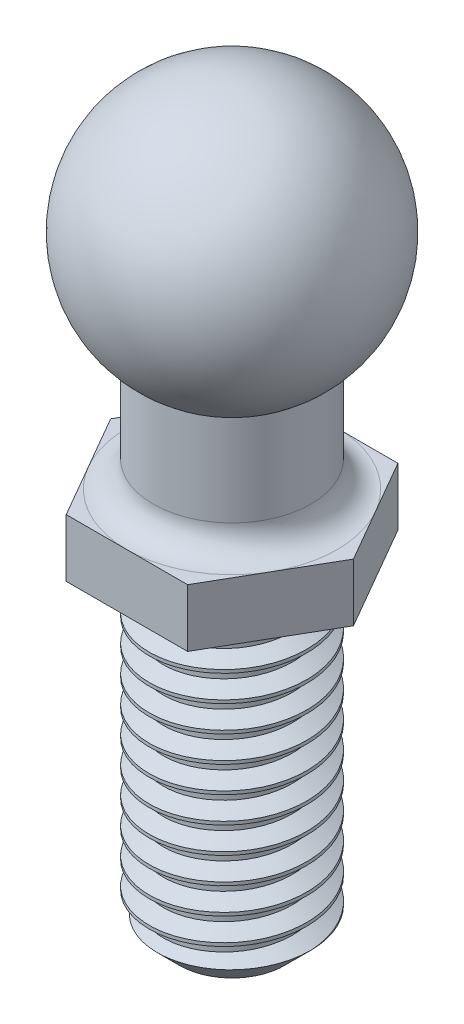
SolidWorks part; units mm, degrees
ref_plane "Plan de face" through (0, 0, 0) normal (0, 0, 1) x (1, 0, 0)
ref_plane "Plan de dessus" through (0, 0, 0) normal (0, 1, 0) x (1, 0, 0)
ref_plane "Plan de droite" through (0, 0, 0) normal (1, 0, 0) x (0, 0, -1)
sketch "Esquisse1" plane through (0, 0, 0) normal (0, 0, 1) x (1, 0, 0)
  line L0 (0, 34.3479) -> (0, -13.7179) construction
  line L1 (3, 19.17) -> (3, 0)
  line L2 (3, 0) -> (0, 0)
  line L3 (0, 28.17) -> (0, 0)
  arc A0 (0, 28.17) -> (3, 19.17) centre (0, 23.17) cw
  dimension "D1" = 5
  dimension "D2" = 3
  dimension "D3" = 19.17
revolve "Révolution1" add sketch "Esquisse1" angle 360 about L0
ref_plane "Plan1" through (0, 12.5, 0) normal (0, -1, 0) x (-1, 0, 0)
sketch "Esquisse2" plane through (0, 12.5, 0) normal (0, -1, 0) x (-1, 0, 0)
  line L1 (2.3094, -4) -> (4.6188, 0)
  line L2 (4.6188, 0) -> (2.3094, 4)
  line L3 (2.3094, 4) -> (-2.3094, 4)
  line L4 (-2.3094, 4) -> (-4.6188, 0)
  line L5 (-4.6188, 0) -> (-2.3094, -4)
  line L6 (-2.3094, -4) -> (2.3094, -4)
  circle A0 centre (0, 0) radius 4 construction
  dimension "D1" = 8
extrude "Boss.-Extru.1" add sketch "Esquisse2" against normal blind 2.2
fillet "Congé1" radius 1 1 edges at (0, 14.7, -3)
chamfer "Chanfrein1" distance 1 angle 45 1 edges at (0, 0, 3)
thread "Filetage2" pitch 1 start angle 0, offset 0, length 0, pitch 1, diameter 6
ref_plane "Plan4" through (3, 0, 0) normal (0, 0, 1) x (1, 0, 0)
sketch "Profil de filetage3" plane through (3, 0, 0) normal (0, 0, 1) x (1, 0, 0)
  line L0 (0, 0) -> (0, 1) construction
  line L11 (0, 0) -> (0, 0.875)
  line L12 (0, 0.875) -> (-0.5413, 0.5625)
  line L13 (-0.5413, 0.5625) -> (-0.5413, 0.3125)
  line L15 (-0.5413, 0.3125) -> (0, 0)
  line L17 (-0.5413, 0.4375) -> (0, 0.4375) construction
  point P2 (0, 0)
  dimension "Pitch" = 1
  dimension "Profile_Angle" = 60
  dimension "Profile_Land" = 0.25
  dimension "Profile_Height" = 0.5413
ref_point "centre rotule"
